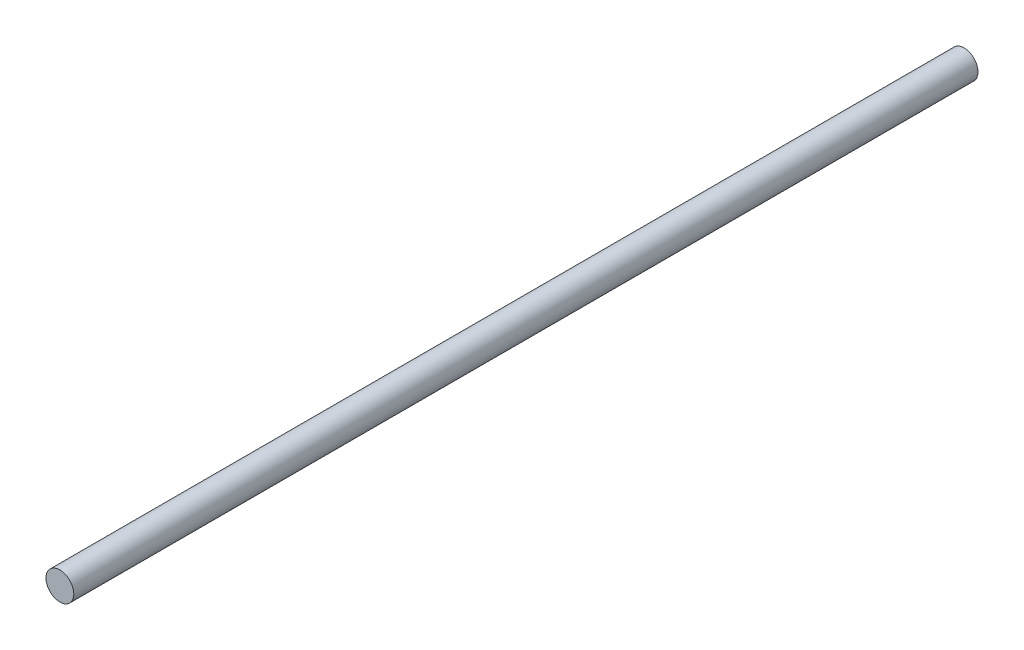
SolidWorks part; units mm, degrees
ref_plane "Front Plane" through (0, 0, 0) normal (0, 0, 1) x (1, 0, 0)
ref_plane "Top Plane" through (0, 0, 0) normal (0, 1, 0) x (1, 0, 0)
ref_plane "Right Plane" through (0, 0, 0) normal (1, 0, 0) x (0, 0, -1)
sketch "Sketch1" plane through (0, 0, 0) normal (0, 0, 1) x (1, 0, 0)
  circle A0 centre (0, 0) radius 30
  dimension "D1" = 60
extrude "Boss-Extrude1" add sketch "Sketch1" against normal blind 1950
